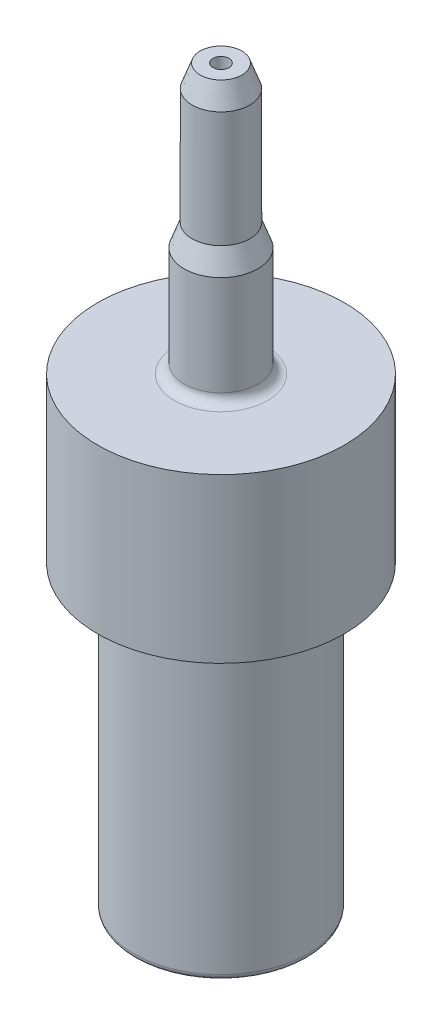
SolidWorks part; units mm, degrees
ref_plane "X_Y" through (0, 0, 0) normal (0, 0, 1) x (1, 0, 0)
ref_plane "Z_X" through (0, 0, 0) normal (0, 1, 0) x (1, 0, 0)
ref_plane "Y_Z" through (0, 0, 0) normal (1, 0, 0) x (0, 0, -1)
sketch "Sketch1" plane through (0, 0, 0) normal (0, 0, 1) x (1, 0, 0)
  line L0 (0, -740.3001) -> (0, 36274.7063) construction
  line L1 (0.25, 0) -> (2.7051, 0)
  line L2 (2.7051, 0) -> (2.7051, 9.4)
  line L3 (2.7051, 9.4) -> (3.85, 9.4)
  line L4 (3.85, 9.4) -> (3.85, 14.5)
  line L5 (3.85, 14.5) -> (1.15, 14.5)
  line L6 (1.15, 14.5) -> (1.15, 17.9131)
  line L8 (0.9, 18.6) -> (0.9, 22.9)
  line L9 (0.9, 22.9) -> (0.25, 22.9)
  line L10 (0.25, 22.9) -> (0.25, 0)
  line L11 (0.9, 18.6) -> (1.15, 17.9131)
  point P1 (2.5, 14.5)
  dimension "D1" = 9.4
  dimension "D2" = 8.4
  dimension "D3" = 4.1
  dimension "D4" = 5.4102
  dimension "D5" = 7.7
  dimension "D6" = 0.5
  dimension "D7" = 22.9
  dimension "D8" = 1.8
  dimension "D9" = 2.3
  dimension "D10" = 20
revolve "Revolve1" add sketch "Sketch1" angle 360 about L0
chamfer "Chamfer1" distance 0.25 angle 70 1 edges at (0.9, 22.9, 0)
fillet "Fillet1" radius 0.3 2 edges at (2.7051, 9.4, 0) (1.15, 14.5, 0)
fillet "Fillet2" radius 0.18 1 edges at (2.7051, 0, 0)
